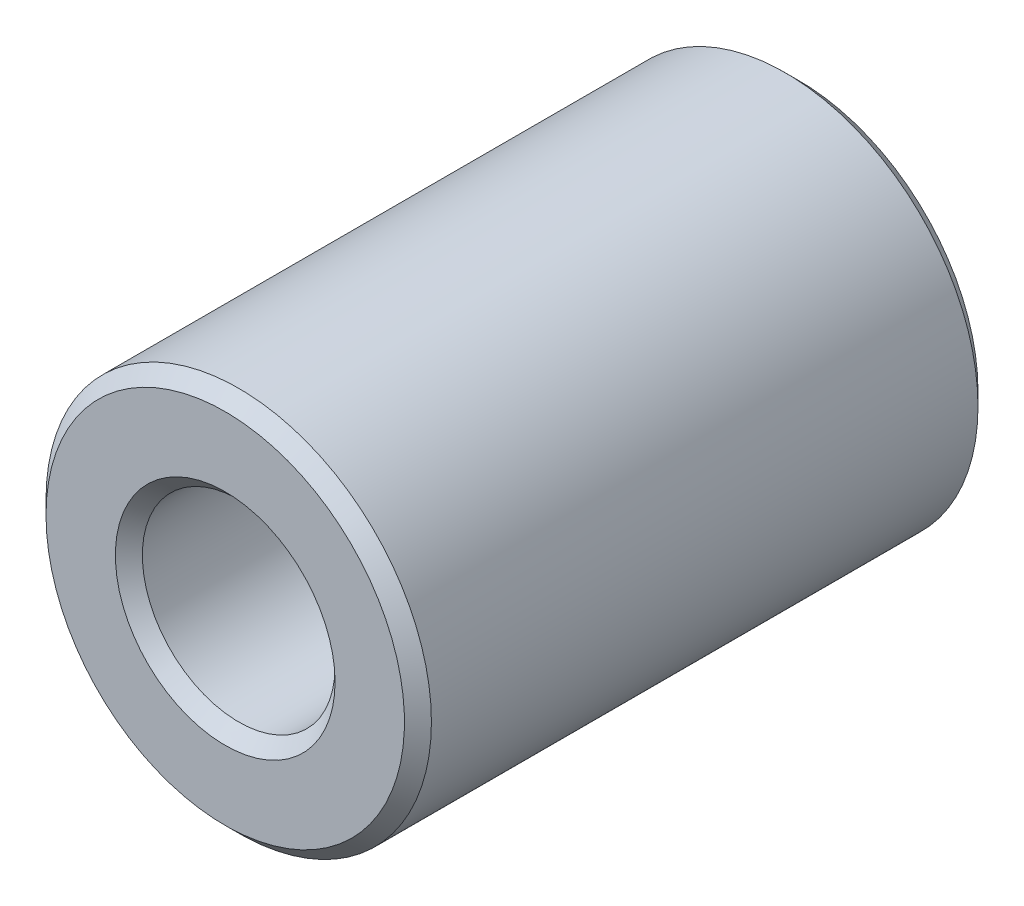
SolidWorks part; units mm, degrees
ref_plane "Front Plane" through (0, 0, 0) normal (0, 0, 1) x (1, 0, 0)
ref_plane "Top Plane" through (0, 0, 0) normal (0, 1, 0) x (1, 0, 0)
ref_plane "Right Plane" through (0, 0, 0) normal (1, 0, 0) x (0, 0, -1)
sketch "Sketch1" plane through (0, 0, 0) normal (0, 0, 1) x (1, 0, 0)
  line L0 (1.6002, 0) -> (3.2004, 0) construction
  circle A0 centre (0, 0) radius 1.6002 construction
  circle A1 centre (0, 0) radius 3.2004 construction
  circle A2 centre (0, 0) radius 3.175 construction
  circle A3 centre (0, 0) radius 1.5875 construction
sketch "Sketch13" plane through (0, 0, 0) normal (1, 0, 0) x (0, 0, -1)
  line L0 (4.7625, 0) -> (-4.7625, 0) construction
  line L1 (4.7625, 3.2004) -> (-4.7625, 3.2004) construction
  line L2 (0, 3.2004) -> (0, -3.2004) construction
  line L3 (0, 3.2004) -> (0, -3.2004) construction
  point P4 (0, 0)
  point P8 (0, 3.2004)
  dimension "Length" = 9.525
sketch "Sketch14" plane through (0, 0, 0) normal (0, 0, 1) x (1, 0, 0)
  circle A0 centre (0, 0) radius 1.6002 construction
  circle A1 centre (0, 0) radius 3.2004 construction
  circle A2 centre (0, 0) radius 1.6002
  circle A3 centre (0, 0) radius 3.2004
extrude "Boss-Extrude1" add sketch "Sketch14" against normal up to vertex (4.7625 mm away) and the other way up to vertex (4.7625 mm away)
chamfer "Chamfer1" distance 0.224 angle 45 4 edges at (3.2004, 0, -4.7625) (1.6002, 0, -4.7625) (1.6002, 0, 4.7625) (3.2004, 0, 4.7625)
equation "\"D1@Chamfer1\"=(\"OD@Sketch1\"-\"ID@Sketch1\")*.07"
